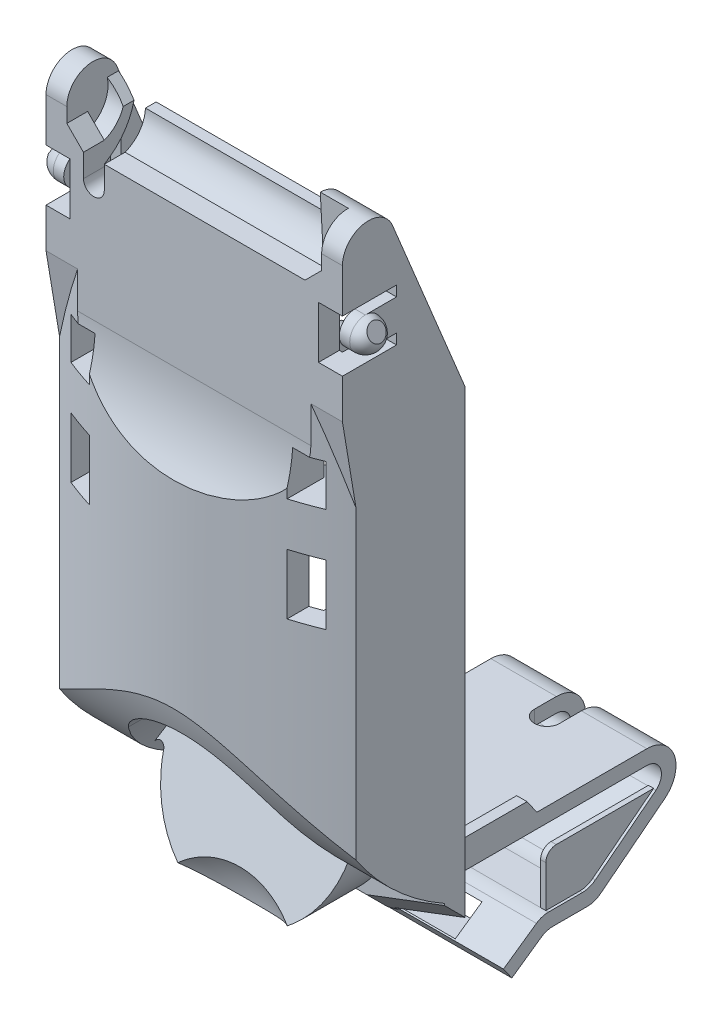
SolidWorks part; units mm, degrees
ref_plane "正面" through (0, 0, 0) normal (0, 0, 1) x (1, 0, 0)
ref_plane "平面" through (0, 0, 0) normal (0, 1, 0) x (1, 0, 0)
ref_plane "右側面" through (0, 0, 0) normal (1, 0, 0) x (0, 0, -1)
imported_body "Cartridge Cover.stp"
sketch "ｽｹｯﾁ3" plane through (9.5, 0, 0) normal (1, 0, 0) x (0, 0, -1)
  line L0 (-7.3, -5.5) -> (-8.8, -5.5)
  line L2 (-8.8, -4) -> (-8.8, -5.5)
  arc A0 (-8.8, -4) -> (-7.3, -5.5) centre (-7.3, -4) ccw construction
  arc A1 (-8.8, -4) -> (-7.3, -5.5) centre (-7.3, -4) ccw
extrude "ｶｯﾄ - 押し出し1" cut sketch "ｽｹｯﾁ3" against normal up to surface (19 mm away)
